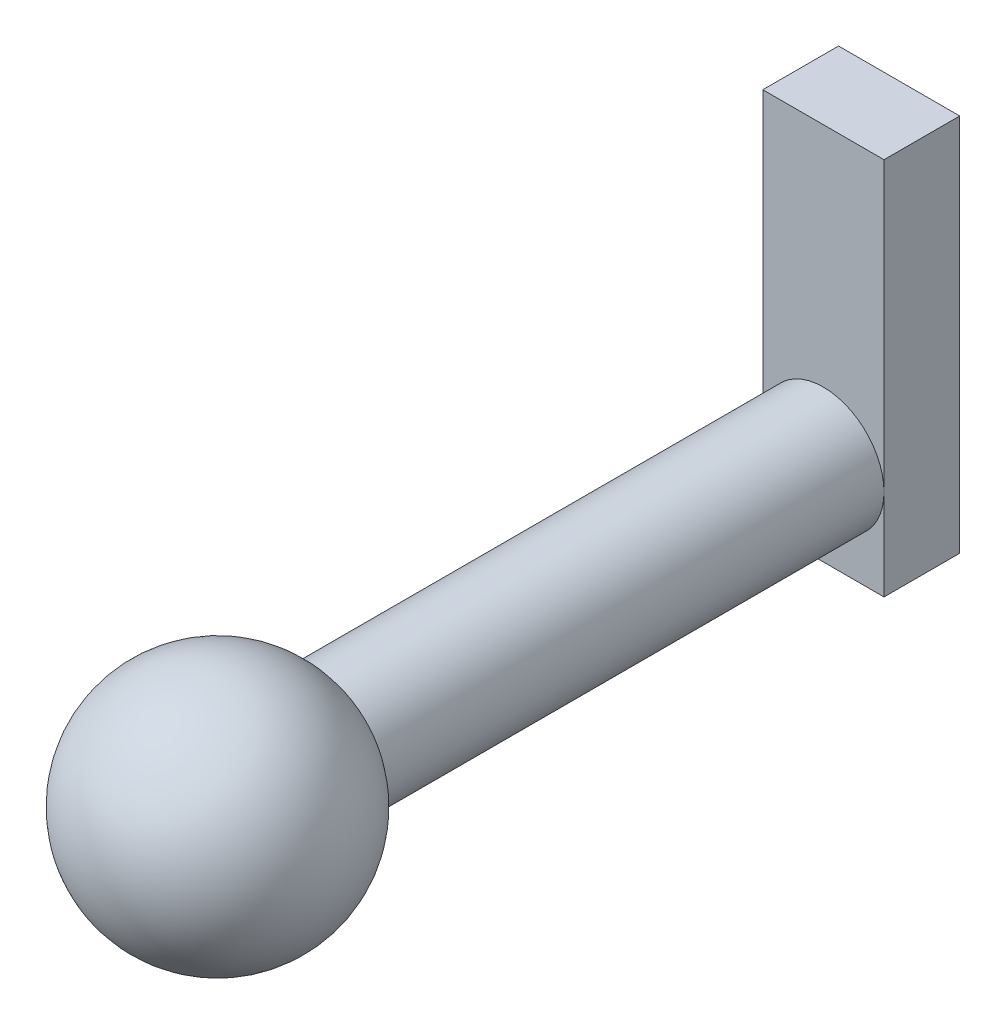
SolidWorks part; units mm, degrees
ref_plane "Plan de face" through (0, 0, 0) normal (0, 0, 1) x (1, 0, 0)
ref_plane "Plan de dessus" through (0, 0, 0) normal (0, 1, 0) x (1, 0, 0)
ref_plane "Plan de droite" through (0, 0, 0) normal (1, 0, 0) x (0, 0, -1)
sketch "Esquisse1" plane through (0, 0, 0) normal (0, 0, 1) x (1, 0, 0)
  circle A0 centre (0, 0) radius 8
extrude "Boss.-Extru.1" add sketch "Esquisse1" along normal blind 80
sketch "Esquisse2" plane through (0, 0, 0) normal (0, 0, -1) x (-1, 0, 0)
  line L1 (-8, -12) -> (8, -12)
  line L2 (-8, -12) -> (-8, 38)
  line L3 (-8, 38) -> (8, 38)
  line L4 (8, -12) -> (8, 38)
  dimension "D1" = 16
  dimension "D2" = 8
  dimension "D3" = 50
  dimension "D4" = 12
extrude "Boss.-Extru.2" add sketch "Esquisse2" along normal blind 10
ref_plane "Plan1" through (0, 0, 10) normal (0, 0, 1) x (1, 0, 0)
sketch "Esquisse3" plane through (0, 0, 10) normal (0, 0, 1) x (1, 0, 0)
  circle A0 centre (0, 0) radius 22
sketch "Esquisse4" plane through (0, 0, 80) normal (0, 0, 1) x (1, 0, 0)
  line L0 (0, 16) -> (0, -16)
  line L1 (0, 19.825) -> (0, -20.368) construction
  arc A0 (0, -16) -> (0, 16) centre (0, 0) ccw
revolve "Révolution1" add sketch "Esquisse4" angle 360 about L1
sketch "Esquisse5" plane through (0, 0, 0) normal (1, 0, 0) x (0, 0, -1)
  point P0 (-80, 0)
